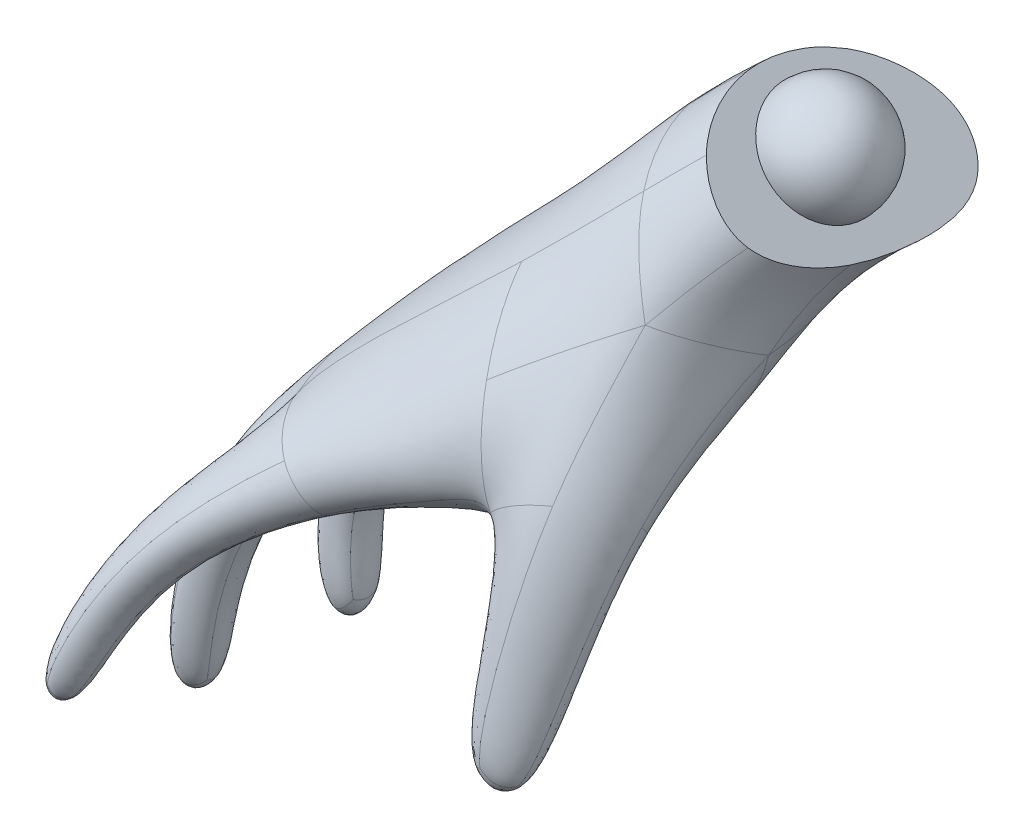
SolidWorks part; units mm, degrees
ref_plane "Front Plane" through (0, 0, 0) normal (0, 0, 1) x (1, 0, 0)
ref_plane "Top Plane" through (0, 0, 0) normal (0, 1, 0) x (1, 0, 0)
ref_plane "Right Plane" through (0, 0, 0) normal (1, 0, 0) x (0, 0, -1)
imported_body "Stock-Source-1"
ref_plane "Plane1" through (0, 0, 142.24) normal (0, 0, 1) x (1, 0, 0)
sketch "Sketch1" plane through (0, 0, 142.24) normal (0, 0, 1) x (1, 0, 0)
  line L0 (-568.8296, 3857.5844) -> (-545.0982, 3833.853)
  line L1 (-564.955, 3853.7099) -> (-572.7041, 3861.4589) construction
  line L2 (-540.2093, 3828.9641) -> (-549.9872, 3838.742) construction
  arc A0 (-545.0982, 3833.853) -> (-568.8296, 3857.5844) centre (-556.9639, 3845.7187) ccw
revolve "Revolve1" add sketch "Sketch1" angle 360 about L0
